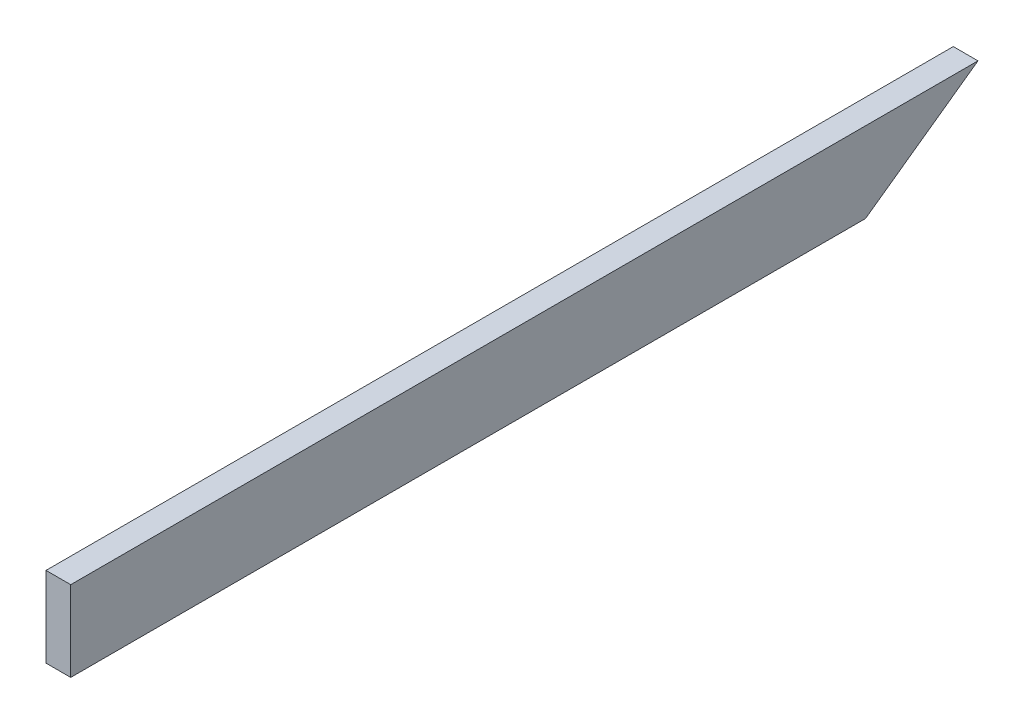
SolidWorks part; units mm, degrees
ref_plane "Plan de face" through (0, 0, 0) normal (0, 0, 1) x (1, 0, 0)
ref_plane "Plan de dessus" through (0, 0, 0) normal (0, 1, 0) x (1, 0, 0)
ref_plane "Plan de droite" through (0, 0, 0) normal (1, 0, 0) x (0, 0, -1)
sketch "Esquisse1" plane through (0, 0, 0) normal (0, 0, 1) x (1, 0, 0)
  line L1 (-2, 6.5) -> (2, 6.5)
  line L2 (-2, 6.5) -> (-2, -6.5)
  line L3 (-2, -6.5) -> (2, -6.5)
  line L4 (2, 6.5) -> (2, -6.5)
  point P4 (0, 6.5)
  point P5 (-2, 0)
  dimension "D1" = 4
  dimension "D2" = 13
extrude "Extrusion1" add sketch "Esquisse1" along normal mid plane 300
sketch "Esquisse2" plane through (-2, 0, 0) normal (-1, 0, 0) x (0, 0, 1)
  line L0 (-150, 6.5) -> (-150, -6.5) construction
  line L1 (150, -6.5) -> (-150, -6.5) construction
  line L2 (150, 6.5) -> (-150, 6.5) construction
  line L3 (-150, 6.5) -> (-150, -6.5)
  line L4 (21.3904, -6.5) -> (-150, -6.5)
  line L5 (3.189, 6.5) -> (-150, 6.5)
  line L6 (21.3904, -6.5) -> (3.189, 6.5)
extrude "Enlèv. mat.-Extru.1" cut sketch "Esquisse2" against normal blind 10
